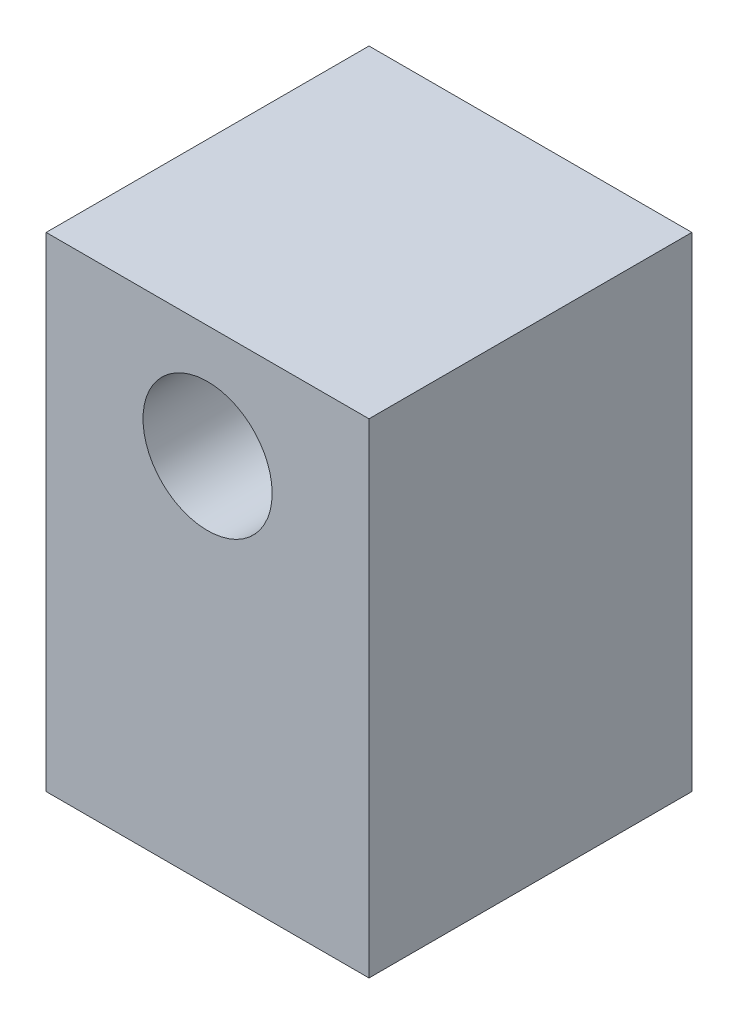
SolidWorks part; units mm, degrees
ref_plane "Front Plane" through (0, 0, 0) normal (0, 0, 1) x (1, 0, 0)
ref_plane "Top Plane" through (0, 0, 0) normal (0, 1, 0) x (1, 0, 0)
ref_plane "Right Plane" through (0, 0, 0) normal (1, 0, 0) x (0, 0, -1)
sketch "Sketch2" plane through (0, 0, 0) normal (0, 0, 1) x (1, 0, 0)
  line L1 (50, -75) -> (-50, -75)
  line L2 (50, -75) -> (50, 75)
  line L3 (50, 75) -> (-50, 75)
  line L4 (-50, -75) -> (-50, 75)
  line L5 (50, -75) -> (-50, 75) construction
  line L6 (50, 75) -> (-50, -75) construction
  circle A0 centre (0, 40) radius 20
  point P0 (0, 0)
  dimension "D4" = 40
  dimension "D1" = 150
  dimension "D2" = 100
  dimension "D3" = 40
extrude "Boss-Extrude1" add sketch "Sketch2" along normal mid plane 100
